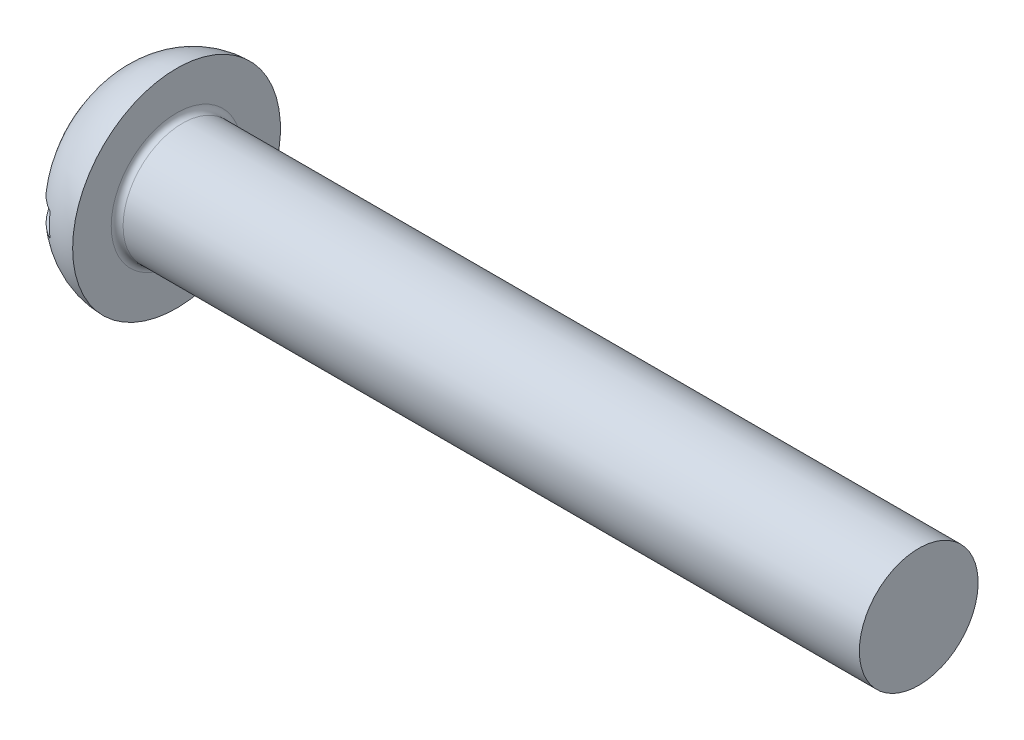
SolidWorks part; units mm, degrees
ref_plane "Front Plane" through (0, 0, 0) normal (0, 0, 1) x (1, 0, 0)
ref_plane "Top Plane" through (0, 0, 0) normal (0, 1, 0) x (1, 0, 0)
ref_plane "Right Plane" through (0, 0, 0) normal (1, 0, 0) x (0, 0, -1)
sketch "BodySke" plane through (0, 0, 0) normal (0, 0, 1) x (1, 0, 0)
  line L0 (0, 0) -> (111.3824, 0) construction
  line L1 (0, 0) -> (0, 8) construction
  line L2 (5.4, 4) -> (5.4, 7)
  line L4 (5.4, 4) -> (55.4, 4)
  line L5 (55.4, 4) -> (55.4, 0)
  line L6 (6.65, 7.824) -> (6.65, -6.8939) construction
  line L7 (0, 0) -> (55.4, 0)
  line L8 (25.4, 8.824) -> (25.4, -4.958) construction
  arc A0 (5.4, 7) -> (1.888, 5.306) centre (5.4541, 2.4003) ccw
  arc A1 (1.888, 5.306) -> (0, 0) centre (8.4, 0) ccw
  point P10 (55.4, 3.4455)
  dimension "Head_side_radius" = 4.6
  dimension "Head_radius" = 8.4
  dimension "Diameter" = 8
  dimension "Head_dia" = 14
  dimension "Head_height" = 5.4
  dimension "Length" = 50
  dimension "Advance" = 1.25
  dimension "Thread_minor" = 6.891
  dimension "Thread_length" = 30
revolve "BaseBody" add sketch "BodySke" angle 360 about L0
fillet "Fillet1" radius 0.4 1 edges at (5.4, 0, 4)
sketch "SlotSke" plane through (0, 0, 0) normal (1, 0, 0) x (0, 0, -1)
  line L1 (7, 0.8) -> (-7, 0.8)
  line L3 (7, 0.8) -> (7, -0.8)
  line L5 (7, -0.8) -> (-7, -0.8)
  line L6 (-7, 0.8) -> (-7, -0.8)
  dimension "D1" = 14
  dimension "D2" = 7
  dimension "Slot_width" = 1.6
  dimension "D4" = 0.8
extrude "Slot" cut sketch "SlotSke" along normal blind 3.3
sketch "ThdSchSke" plane through (0, 0, 0) normal (0, 0, 1) x (1, 0, 0)
  line L0 (0, 0) -> (55.1256, 0) construction
  line L1 (0, 0) -> (111.3824, 0) construction
  line L2 (55.0799, 4) -> (55.0799, 4.6403)
  line L3 (55.0799, 4.6403) -> (55.7201, 4.6403)
  line L4 (55.7201, 4.6403) -> (55.7201, 4)
  line L5 (55.7201, 4) -> (55.4, 3.4455)
  line L6 (55.4, 3.4455) -> (55.0799, 4)
  line L7 (5.4, 4) -> (55.4, 4) construction
  line L13 (55.4, 4) -> (55.4, 0) construction
revolve "ThreadSchematic" [suppressed] cut sketch "ThdSchSke" angle 360 about L0
pattern_linear "ThdSchPat" [suppressed] count 24 along (1, 0, 0)
equation "\"Thread_minor@ThreadCosmetic\" = \"Thread_minor@BodySke\""
equation "\"Advance@ThdSchPat\" = \"Advance@BodySke\""
equation "\"D1@ThdSchPat\" =  int( \"Thread_length@BodySke\" / \"Advance@ThdSchPat\" ) "
equation "\"D1@SlotSke\" = \"Head_dia@BodySke\""
equation "\"D2@SlotSke\" = \"D1@SlotSke\" / 2"
equation "\"D4@SlotSke\" = \"Slot_width@SlotSke\" / 2"
